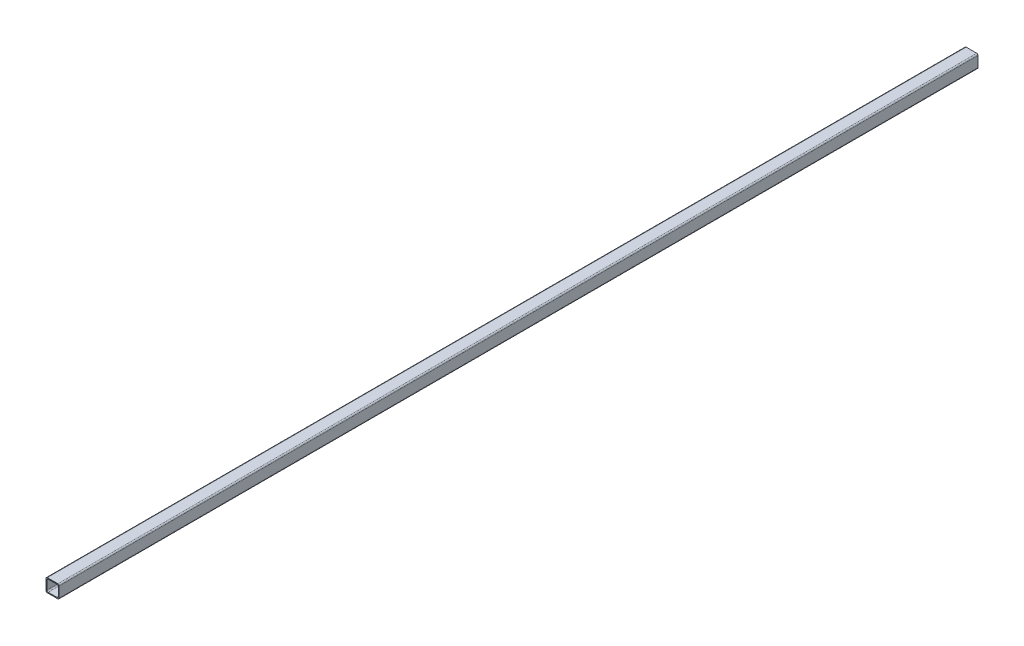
SolidWorks part; units mm, degrees
ref_plane "Plan de face" through (0, 0, 0) normal (0, 0, 1) x (1, 0, 0)
ref_plane "Plan de dessus" through (0, 0, 0) normal (0, 1, 0) x (1, 0, 0)
ref_plane "Plan de droite" through (0, 0, 0) normal (1, 0, 0) x (0, 0, -1)
sketch "Esquisse1" plane through (0, 0, 0) normal (0, 0, 1) x (1, 0, 0)
  line L1 (0, 0) -> (30, 0)
  line L2 (0, 0) -> (0, 30)
  line L3 (0, 30) -> (30, 30)
  line L4 (30, 0) -> (30, 30)
  dimension "D1" = 30
  dimension "D2" = 30
extrude "Extru.-Mince1" add sketch "Esquisse1" along normal blind 2100 thin
fillet "Congé1" radius 3 8 edges at (2, 28, 1050) (28, 2, 1050) (0, 0, 1050) (28, 28, 1050) (30, 0, 1050) (2, 2, 1050) (0, 30, 1050) (30, 30, 1050)
